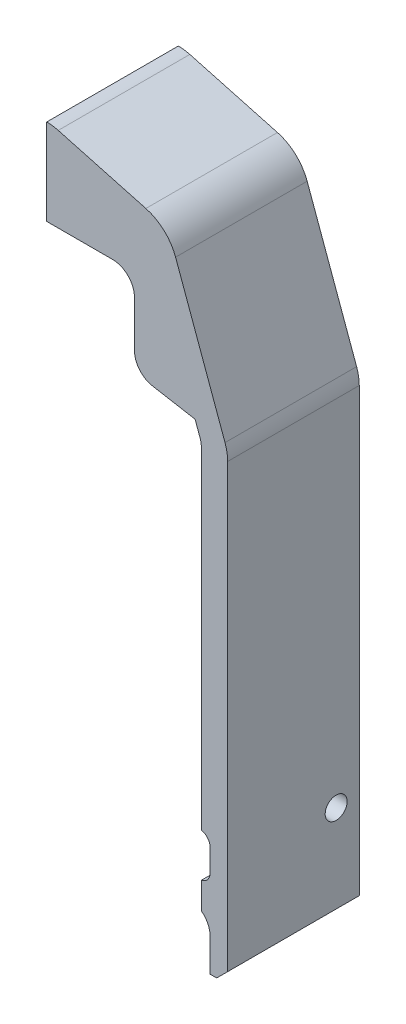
SolidWorks part; units mm, degrees
ref_plane "Face" through (0, 0, 0) normal (0, 0, 1) x (1, 0, 0)
ref_plane "Dessus" through (0, 0, 0) normal (0, 1, 0) x (1, 0, 0)
ref_plane "Droite" through (0, 0, 0) normal (1, 0, 0) x (0, 0, -1)
sketch "Esquisse1" plane through (0, 0, 0) normal (0, 0, 1) x (1, 0, 0)
  line L0 (-74.5, 0) -> (-82.5, 0)
  line L1 (-82.5, 0) -> (-82.5, 206.4735)
  line L2 (-81.2939, 213.3139) -> (-58.7478, 275.2586)
  line L3 (-45.1984, 287.7183) -> (0, 300)
  line L4 (0, 300) -> (0, 287.5649)
  line L5 (0, 287.5649) -> (-41.0513, 276.4101)
  line L6 (-47.8261, 270.1802) -> (-69.8969, 209.541)
  line L7 (-70.5, 206.1208) -> (-70.5, 54.899)
  line L8 (-74.5, 0) -> (-74.5, 15)
  line L9 (-74.5, 50) -> (-74.5, 40)
  line L10 (-70.5, 35.101) -> (-70.5, 23)
  arc A0 (-74.5, 15) -> (-70.5, 23) centre (-64.5, 15) cw
  arc A1 (-74.5, 40) -> (-70.5, 35.101) centre (-69.5, 40) ccw
  arc A2 (-74.5, 50) -> (-70.5, 54.899) centre (-69.5, 50) cw
  arc A3 (-41.0513, 276.4101) -> (-47.8261, 270.1802) centre (-38.4291, 266.76) ccw
  arc A4 (-69.8969, 209.541) -> (-70.5, 206.1208) centre (-60.5, 206.1208) ccw
  arc A5 (-82.5, 206.4735) -> (-81.2939, 213.3139) centre (-62.5, 206.4735) cw
  arc A6 (-58.7478, 275.2586) -> (-45.1984, 287.7183) centre (-39.954, 268.4182) cw
  point P24 (-82.5, 210)
  point P27 (-55.2022, 285)
  dimension "D9" = 10
  dimension "D10" = 20
  dimension "D13" = 10
  dimension "D14" = 5
  dimension "D15" = 5
  dimension "D1" = 12
  dimension "D2" = 12
  dimension "D3" = 160
  dimension "D4" = 75
  dimension "D5" = 12
  dimension "D6" = 82.5
  dimension "D7" = 300
  dimension "D8" = 210
  dimension "D11" = 8
  dimension "D12" = 15
  dimension "D16" = 40
  dimension "D17" = 10
extrude "Base-Extrusion" add sketch "Esquisse1" along normal blind 60
sketch "Esquisse2" plane through (0, 0, 60) normal (0, 0, 1) x (1, 0, 0)
  line L0 (0, 300) -> (0, 260)
  line L1 (0, 260) -> (-30, 260)
  line L2 (-40, 250) -> (-40, 228.9861)
  line L3 (-48.2635, 219.138) -> (-81.2939, 213.3139)
  line L4 (0, 300) -> (-45.1984, 287.7183)
  line L5 (-81.2939, 213.3139) -> (-58.7478, 275.2586)
  line L10 (0, 300) -> (-45.1984, 287.7183) construction
  line L11 (-58.7478, 275.2586) -> (-81.2939, 213.3139) construction
  arc A0 (-81.2939, 213.3139) -> (-82.5, 206.4735) centre (-62.5, 206.4735) ccw construction
  arc A1 (-45.1984, 287.7183) -> (-58.7478, 275.2586) centre (-39.954, 268.4182) ccw
  arc A2 (-30, 260) -> (-40, 250) centre (-30, 250) ccw
  arc A3 (-48.2635, 219.138) -> (-40, 228.9861) centre (-50, 228.9861) ccw
  point P18 (-40, 260)
  point P23 (0, 260)
  dimension "D3" = 20
  dimension "D5" = 10
  dimension "D6" = 10
  dimension "D1" = 40
  dimension "D2" = 40
  dimension "D4" = 100
extrude "Boss.-Extru.1" add sketch "Esquisse2" against normal blind 5
sketch "Esquisse3" plane through (-74.5, 0, 0) normal (1, 0, 0) x (0, 0, -1)
  circle A0 centre (-10.54, 45) radius 10
  dimension "D1" = 45
  dimension "D3" = 20
  dimension "D2" = 49.46
extrude "Boss.-Extru.2" add sketch "Esquisse3" along normal blind 15.5
fillet "Congé2" radius 2
sketch "Esquisse4" plane through (-59, 0, 0) normal (1, 0, 0) x (0, 0, -1)
  circle A0 centre (-10.54, 45) radius 5
  dimension "D1" = 10
extrude "Enlèv. mat.-Extru.1" cut sketch "Esquisse4" against normal through all
mirror "Symétrie1"
fillet "Congé3" radius 20
chamfer "Chanfrein1" distance 5 angle 45
sketch "Esquisse5" plane through (0, 0, 60) normal (0, 0, 1) x (1, 0, 0)
  line L1 (0, 0) -> (-120, 0)
  line L2 (0, 0) -> (0, 310)
  line L3 (0, 310) -> (-120, 310)
  line L4 (-120, 0) -> (-120, 310)
extrude "Enlèv. mat.-Extru.2" cut sketch "Esquisse5" against normal blind 90
